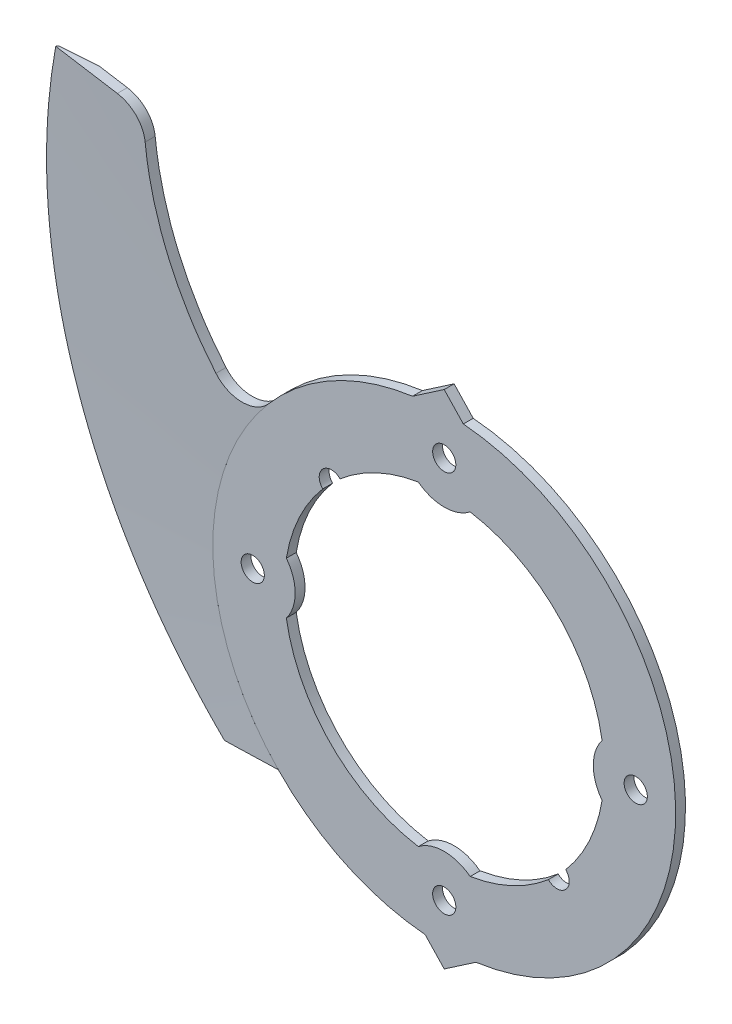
SolidWorks part; units mm, degrees
ref_plane "Plane1" through (0, 0, 0) normal (0, 0, 1) x (1, 0, 0)
ref_plane "Plane2" through (0, 0, 0) normal (0, 1, 0) x (1, 0, 0)
ref_plane "Plane3" through (0, 0, 0) normal (1, 0, 0) x (0, 0, -1)
sketch "bottom blade profile" plane through (0, 0, 0) normal (0, 0, 1) x (1, 0, 0)
  line L4 (0, 22.93) -> (1.748, 21.0776)
  line L5 (0, 22.93) -> (-2.8949, 20.9509)
  line L6 (0, -22.93) -> (-1.748, -21.0776)
  line L7 (0, -22.93) -> (2.8949, -20.9509)
  line L16 (-34.4289, 33.4215) -> (-26.6559, 31.8505)
  line L17 (-19.9446, -14.7432) -> (-15.1645, -14.7432)
  arc A2 (-2.8949, 20.9509) -> (-18.1047, 10.9336) centre (0, 0) ccw
  arc A3 (2.8949, -20.9509) -> (1.748, 21.0776) centre (0, 0) ccw
  arc A4 (-15.1645, -14.7432) -> (-1.748, -21.0776) centre (0, 0) ccw
  circle A6 centre (17.5, 0) radius 1.06
  circle A8 centre (0, -17.5) radius 1.06
  circle A10 centre (-17.5, 0) radius 1.06
  circle A12 centre (0, 17.5) radius 1.06
  arc A40 (9.5156, -11.0995) -> (11.0962, -11.0962) centre (10.3042, -10.3042) ccw
  arc A41 (11.0962, -11.0962) -> (11.0995, -9.5156) centre (10.3042, -10.3042) ccw
  arc A42 (11.0995, -9.5156) -> (14.4269, -2.3686) centre (0, 0) ccw
  arc A43 (14.4269, 2.3686) -> (14.4269, -2.3686) centre (17.5, 0) ccw
  arc A44 (14.4269, 2.3686) -> (2.3686, 14.4269) centre (0, 0) ccw
  arc A45 (-2.3686, 14.4269) -> (2.3686, 14.4269) centre (0, 17.5) ccw
  arc A46 (-2.3686, 14.4269) -> (-9.5156, 11.0995) centre (0, 0) ccw
  arc A47 (-9.5156, 11.0995) -> (-11.0962, 11.0962) centre (-10.3042, 10.3042) ccw
  arc A48 (-11.0962, 11.0962) -> (-11.0995, 9.5156) centre (-10.3042, 10.3042) ccw
  arc A49 (-11.0995, 9.5156) -> (-14.4269, 2.3686) centre (0, 0) ccw
  arc A50 (-14.4269, -2.3686) -> (-14.4269, 2.3686) centre (-17.5, 0) ccw
  arc A51 (-14.4269, -2.3686) -> (-2.3686, -14.4269) centre (0, 0) ccw
  arc A52 (2.3686, -14.4269) -> (-2.3686, -14.4269) centre (0, -17.5) ccw
  arc A53 (2.3686, -14.4269) -> (9.5156, -11.0995) centre (0, 0) ccw
  arc A56 (-26.6559, 31.8505) -> (-18.1047, 10.9336) centre (2.814, 31.6919) ccw
  arc A57 (-34.4289, 33.4215) -> (-19.9446, -14.7432) centre (17.7955, 22.8664) ccw
extrude "basic blade profile" add sketch "bottom blade profile" along normal blind 10
fillet "blade fillets" radius 3
sketch "Sketch4" plane through (0, 0, 10) normal (0, 0, 1) x (1, 0, 0)
  line L0 (0, -22.93) -> (2.8949, -20.9509) construction
  line L1 (0, -22.93) -> (-1.748, -21.0776) construction
  line L2 (0, 22.93) -> (-2.8949, 20.9509) construction
  line L3 (0, 22.93) -> (1.748, 21.0776) construction
  line L4 (0, -22.93) -> (2.8949, -20.9509)
  line L5 (0, -22.93) -> (-1.748, -21.0776)
  line L6 (0, 22.93) -> (-2.8949, 20.9509)
  line L7 (0, 22.93) -> (1.748, 21.0776)
  arc A0 (2.8949, -20.9509) -> (1.748, 21.0776) centre (0, 0) ccw construction
  arc A1 (-15.1645, -14.7432) -> (-1.748, -21.0776) centre (0, 0) ccw construction
  arc A2 (-2.8949, 20.9509) -> (-16.0378, 13.7881) centre (0, 0) ccw construction
  arc A3 (2.8949, -20.9509) -> (1.748, 21.0776) centre (0, 0) ccw
  arc A4 (-16.0378, 13.7881) -> (-1.748, -21.0776) centre (0, 0) ccw
  arc A5 (-2.8949, 20.9509) -> (-16.0378, 13.7881) centre (0, 0) ccw
extrude "round section cut" cut sketch "Sketch4" against normal offset from surface (9.1 mm away) 0.9
sketch "Sketch5" plane through (0, 0, 10) normal (0, 0, 1) x (1, 0, 0)
  line L4 (-28.9796, 32.3201) -> (-34.4289, 33.4215)
  line L5 (-19.9446, -14.7432) -> (-15.1645, -14.7432)
  line L7 (-28.9796, 32.3201) -> (-34.4289, 33.4215)
  line L8 (-19.9446, -14.7432) -> (-15.1645, -14.7432)
  arc A4 (-26.5815, 29.5932) -> (-28.9796, 32.3201) centre (-29.5739, 29.3796) ccw
  arc A5 (-16.0378, 13.7881) -> (-15.1645, -14.7432) centre (0, 0) ccw
  arc A6 (-26.5815, 29.5932) -> (-28.9796, 32.3201) centre (-29.5739, 29.3796) ccw
  arc A7 (-26.5815, 29.5932) -> (-20.7071, 13.9364) centre (2.814, 31.6919) ccw
  arc A9 (-34.4289, 33.4215) -> (-19.9446, -14.7432) centre (17.7955, 22.8664) ccw
  arc A10 (-16.0378, 13.7881) -> (-15.1645, -14.7432) centre (0, 0) ccw
  arc A11 (-20.7071, 13.9364) -> (-16.0378, 13.7881) centre (-18.3127, 15.7438) ccw
  arc A12 (-26.5815, 29.5932) -> (-20.7071, 13.9364) centre (2.814, 31.6919) ccw
  arc A13 (-20.7071, 13.9364) -> (-16.0378, 13.7881) centre (-18.3127, 15.7438) ccw
  arc A14 (-34.4289, 33.4215) -> (-19.9446, -14.7432) centre (17.7955, 22.8664) ccw
  dimension "D1" = 0
extrude "blade section cut" cut sketch "Sketch5" against normal offset from surface (8.02 mm away) 1.98
sketch "blade bend sketch" plane through (0, 0, 0) normal (0, 0, -1) x (-1, 0, 0)
  line L0 (0, 0) -> (-20.634, 0) construction
  line L1 (-20.634, 0) -> (34.4289, 33.4215)
ref_plane "blade bend plane" through (5.5552, 9.1524, 0) normal (0.5189, 0.8549, 0) x (0, 0, -1)
sketch "blade bottom sketch" plane through (5.5552, 9.1524, 0) normal (0.5189, 0.8549, 0) x (0, 0, -1)
  line L0 (0.4292, 0) -> (-1.98, 0)
  line L2 (0.4292, 0) -> (-1.98, 46.773)
  line L3 (-8.8034, 46.2132) -> (-1.9344, 46.2132) construction
  line L4 (-1.98, 46.773) -> (-1.98, 0)
  line L7 (-18.0164, 39.174) -> (-15.6486, 39.174) construction
ref_plane "blade revolve plane" through (0, 0, 0) normal (-0.6965, -0.7175, 0) x (0.7175, -0.6965, 0)
sketch "Sketch9" plane through (0, 0, 0) normal (-0.6965, -0.7175, 0) x (0.7175, -0.6965, 0)
  line L1 (-0.6118, 0.9) -> (-21.1114, 0.9) construction
  line L2 (-47.9827, 1.98) -> (-2.3889, 1.98) construction
  line L3 (-18.5705, 0.9) -> (-22.5551, 0.9) construction
  line L4 (-21.1354, 0.9) -> (-47.9827, 1.98)
  line L5 (-47.9827, 1.98) -> (-21.1354, 1.98)
  line L7 (0, 0) -> (0, 39.3408) construction
  line L8 (0, 0.9) -> (0, 1.98) construction
  line L12 (-21.1354, 0.9) -> (-21.1354, 1.98)
revolve "blade bottom cut" cut sketch "Sketch9" angle 360 about L7
sketch "Sketch11" plane through (0, 0, 0) normal (-0.6965, -0.7175, 0) x (0.7175, -0.6965, 0)
  line L0 (-47.9827, 1.98) -> (-21.1114, 0.9) construction
  line L1 (-21.59, 0) -> (-47.9827, 1.0608)
  line L3 (-47.9827, 1.98) -> (-47.9827, 0) construction
  line L5 (-47.9827, 1.0608) -> (-47.9827, 0)
  line L6 (-47.9827, 0) -> (-21.59, 0)
  line L7 (-47.9827, 0) -> (-4.0417, 0) construction
  line L9 (0, 0) -> (0, 5.4715) construction
  line L10 (0, 0) -> (0, 39.3408) construction
revolve "blade top cut" cut sketch "Sketch11" angle 360 about L9
chamfer "blade grind" distance 0.75 distance2 3
chamfer "edge grind" distance 0.12 angle 45
sketch "Sketch14" plane through (0, 0, 0.9) normal (0, 0, 1) x (1, 0, 0)
  line L0 (2.8949, -20.9509) -> (0, -22.93) construction
  line L1 (-1.748, -21.0776) -> (0, -22.93) construction
  line L2 (2.8949, -20.9509) -> (0, -22.93)
  line L3 (-1.748, -21.0776) -> (0, -22.93)
  line L4 (-1.748, -21.0776) -> (2.8949, -20.9509)
extrude "triangulr rib fill 1" add sketch "Sketch14" along normal up to surface (0.9 mm away)
sketch "Sketch15" plane through (0, 0, 0.9) normal (0, 0, 1) x (1, 0, 0)
  line L0 (1.748, 21.0776) -> (0, 22.93) construction
  line L1 (-2.8949, 20.9509) -> (0, 22.93) construction
  line L2 (1.748, 21.0776) -> (0, 22.93)
  line L3 (-2.8949, 20.9509) -> (0, 22.93)
  line L4 (-2.8949, 20.9509) -> (1.748, 21.0776)
extrude "triangular rib fill 2" add sketch "Sketch15" along normal up to surface (0.9 mm away)
